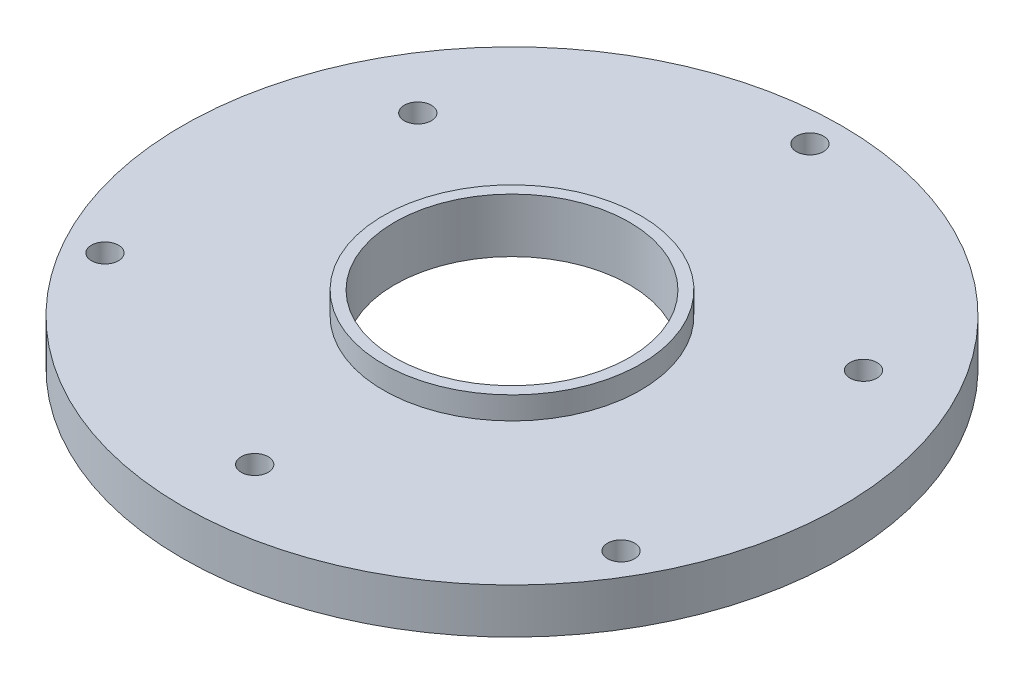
SolidWorks part; units mm, degrees
ref_plane "Piano frontale" through (0, 0, 0) normal (0, 0, 1) x (1, 0, 0)
ref_plane "Piano superiore" through (0, 0, 0) normal (0, 1, 0) x (1, 0, 0)
ref_plane "Piano destro" through (0, 0, 0) normal (1, 0, 0) x (0, 0, -1)
sketch "Schizzo1" plane through (0, 0, 0) normal (0, 0, 1) x (1, 0, 0)
  line L0 (0, 0) -> (0, 68.8521) construction
  line L4 (36.5, 39.3859) -> (36.5, 34.3859)
  line L10 (21, 34.3859) -> (36.5, 34.3859)
  line L11 (21, 34.3859) -> (21, 35.8859)
  line L12 (21, 35.8859) -> (13, 35.8859)
  line L15 (13, 41.8859) -> (14.25, 41.8859)
  line L16 (14.25, 41.8859) -> (14.25, 39.3859)
  line L17 (13, 35.8859) -> (13, 41.8859)
  line L18 (14.25, 39.3859) -> (36.5, 39.3859)
  dimension "D1" = 14.25
  dimension "D2" = 36.5
  dimension "D3" = 1.5
  dimension "D4" = 2.5
  dimension "D5" = 13
  dimension "D6" = 5
  dimension "D7" = 21
revolve "Rivoluzione1" add sketch "Schizzo1" angle 360 about L0
sketch "Schizzo2" plane through (0, 39.3859, 0) normal (0, 1, 0) x (1, 0, 0)
  circle A0 centre (0, 33) radius 1.5
  circle A1 centre (28.5788, -16.5) radius 1.5
  circle A2 centre (-28.5788, -16.5) radius 1.5
  point P10 (0, 0)
  dimension "D1" = 3
  dimension "D2" = 33
  dimension "D3" = 3
extrude "Taglio-Estrusione1" cut sketch "Schizzo2" against normal through all
sketch "Schizzo6" plane through (0, 34.3859, 0) normal (0, -1, 0) x (-1, 0, 0)
  circle A0 centre (0, -28.5) radius 1.5
  circle A1 centre (-24.6817, 14.25) radius 1.5
  circle A2 centre (24.6817, 14.25) radius 1.5
  point P10 (0, 0)
  dimension "D1" = 28.5
  dimension "D3" = 3
  dimension "D2" = 3
extrude "Taglio-Estrusione3" cut sketch "Schizzo6" against normal through all contours A1
